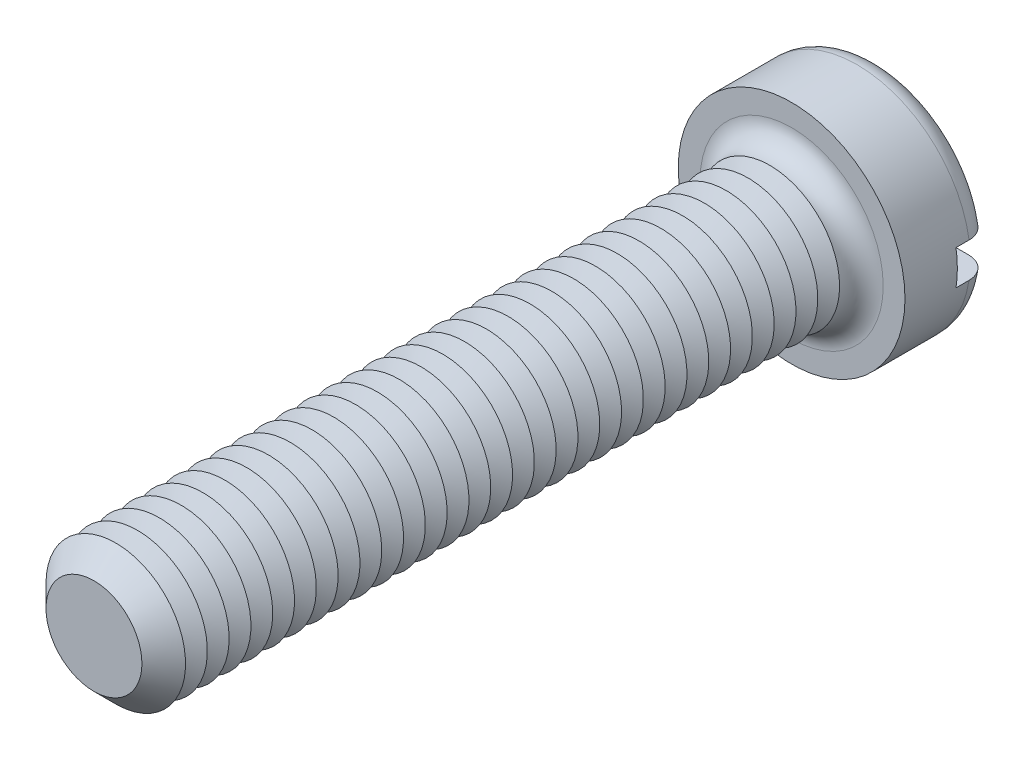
SolidWorks part; units mm, degrees
ref_plane "Front Plane" through (0, 0, 0) normal (0, 0, 1) x (1, 0, 0)
ref_plane "Top Plane" through (0, 0, 0) normal (0, 1, 0) x (1, 0, 0)
ref_plane "Right Plane" through (0, 0, 0) normal (1, 0, 0) x (0, 0, -1)
sketch "Sketch3" plane through (0, 0, 0) normal (0, 0, 1) x (1, 0, 0)
  circle A0 centre (0, 0) radius 6.5
  dimension "D1" = 13
extrude "Boss-Extrude2" add sketch "Sketch3" against normal blind 5
sketch "Sketch4" plane through (0, 0, 0) normal (0, 0, 1) x (1, 0, 0)
  circle A0 centre (0, 0) radius 4
  dimension "D1" = 8
extrude "Boss-Extrude3" add sketch "Sketch4" along normal blind 40
fillet "Fillet1" radius 1.25 2 edges at (6.5, 0, -5) (4, 0, 0)
chamfer "Chamfer1" distance 1.25 angle 45 1 edges at (4, 0, 40)
sketch "Sketch5" plane through (0, 0, 0) normal (1, 0, 0) x (0, 0, -1)
  line L0 (1.6944, 0) -> (-7.6738, 0) construction
sketch "Sketch6" plane through (0, 0, 0) normal (1, 0, 0) x (0, 0, -1)
  line L0 (-1.25, 4) -> (-1.875, 2.9175)
  line L1 (-1.875, 2.9175) -> (-2.5, 4)
  line L2 (-1.25, 4) -> (-38.75, 4) construction
  line L3 (-2.5, 4) -> (-1.25, 4)
  dimension "D1" = 1.25
revolve "Cut-Revolve1" cut sketch "Sketch6" angle 360 about L0
pattern_linear "LPattern1" count 30 spacing 1.25 along (0, 0, 1) of "Cut-Revolve1"
sketch "Sketch8" plane through (0, 0, -5) normal (0, 0, -1) x (-1, 0, 0)
  line L1 (6.5, -1) -> (-6.5, -1)
  line L2 (6.5, -1) -> (6.5, 1)
  line L3 (6.5, 1) -> (-6.5, 1)
  line L4 (-6.5, -1) -> (-6.5, 1)
  line L5 (6.5, -1) -> (-6.5, 1) construction
  line L6 (6.5, 1) -> (-6.5, -1) construction
  point P0 (0, 0)
  dimension "D1" = 13
  dimension "D2" = 2
extrude "Cut-Extrude1" cut sketch "Sketch8" against normal blind 2
